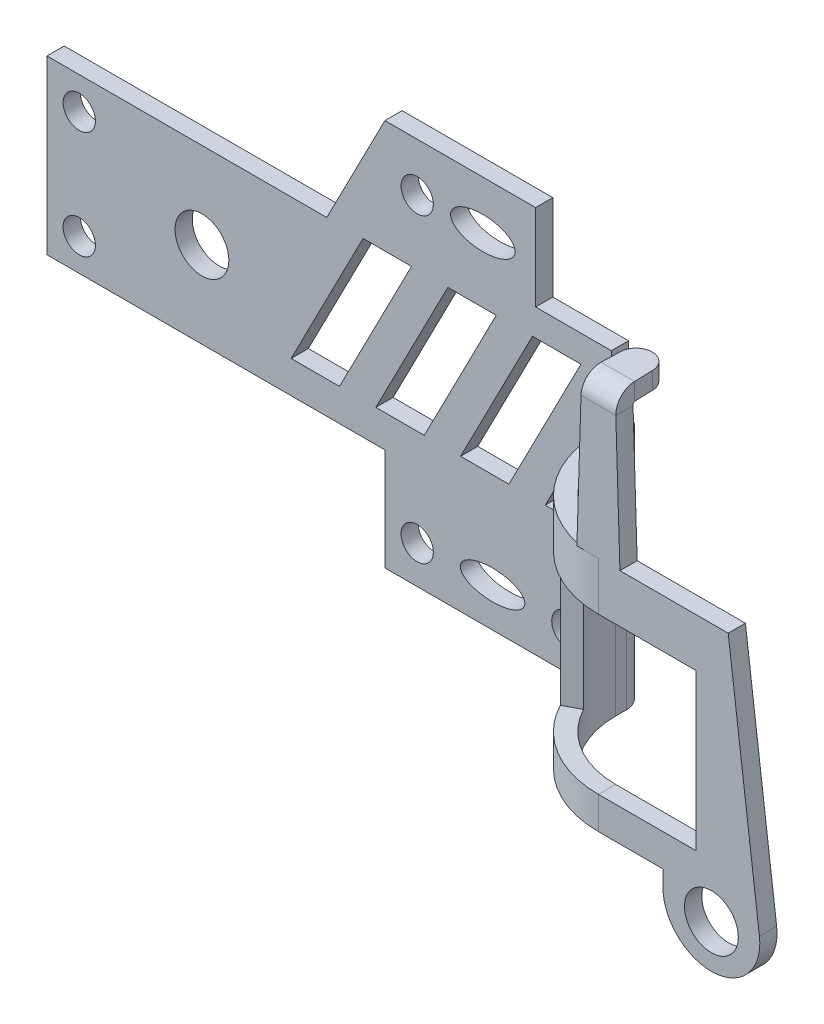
SolidWorks part; units mm, degrees
ref_plane "Face" through (0, 0, 0) normal (0, 0, 1) x (1, 0, 0)
ref_plane "Dessus" through (0, 0, 0) normal (0, 1, 0) x (1, 0, 0)
ref_plane "Droite" through (0, 0, 0) normal (1, 0, 0) x (0, 0, -1)
sketch "Esquisse1" plane through (0, 0, 0) normal (0, 0, 1) x (1, 0, 0)
  line L0 (0, 0) -> (0, 4.75)
  line L1 (0, 4.75) -> (-15.7, 4.75)
  line L2 (-15.7, 4.75) -> (-15.7, 12.75)
  line L3 (-15.7, 12.75) -> (-2.7, 12.75)
  line L4 (-2.7, 12.75) -> (0, 18)
  line L5 (0, 18) -> (7, 18)
  line L6 (7, 18) -> (7, 14)
  line L7 (7, 14) -> (11, 14)
  line L8 (11, 14) -> (11, 11)
  line L9 (11, 11) -> (12.1, 11)
  line L10 (18.95, 11) -> (20.401, -0.4675)
  line L11 (15.9188, 0) -> (12.1, 0)
  line L12 (15.9188, 0) -> (15.9188, -0.75)
  line L13 (18.1688, -3) -> (20.4188, -3) construction
  line L14 (20.4188, -1) -> (20.4188, -3) construction
  line L15 (12.1, 11) -> (18.95, 11)
  line L16 (12.1, 0) -> (0, 0)
  line L17 (12.1, 0) -> (12.1, 11) construction
  line L18 (5, 0) -> (5, 4.5) construction
  line L19 (1.5, 2.5) -> (5, 2.5) construction
  line L20 (1.5, 1.75) -> (1.5, 15.75) construction
  line L21 (-14.2, 6.25) -> (-14.2, 11.25) construction
  line L22 (1.5, 15.75) -> (4.55, 15.75) construction
  line L23 (1.5, 16.5) -> (4.5523, 16.5) construction
  line L24 (-8.5, 8.75) -> (-15.7, 8.75) construction
  line L25 (-4.3561, 6.25) -> (-1.0133, 12.75)
  line L26 (-4.3561, 6.25) -> (-2.1071, 6.25)
  line L27 (-1.0133, 12.75) -> (1.2357, 12.75)
  line L28 (-2.1071, 6.25) -> (1.2357, 12.75)
  line L29 (2.9225, 12.75) -> (5.1715, 12.75)
  line L30 (18.1688, -1) -> (18.1688, -0.75) construction
  line L31 (-0.4204, 6.25) -> (1.8286, 6.25)
  line L32 (1.8286, 6.25) -> (5.1715, 12.75)
  line L33 (-0.4204, 6.25) -> (2.9225, 12.75)
  line L34 (6.8582, 12.75) -> (9.1072, 12.75)
  line L36 (3.5154, 6.25) -> (5.7643, 6.25)
  line L37 (5.7643, 6.25) -> (9.1072, 12.75)
  line L38 (3.5154, 6.25) -> (6.8582, 12.75)
  line L39 (7.4511, 6.25) -> (9.1072, 9.4702)
  line L40 (9.1072, 9.4702) -> (9.1072, 6.25)
  line L41 (9.1072, 6.25) -> (7.4511, 6.25)
  line L42 (-7.8285, 12.75) -> (5.1715, 12.75)
  line L43 (-11.7643, 12.75) -> (1.2357, 12.75)
  arc A0 (15.9188, -0.75) -> (20.401, -0.4675) centre (18.1688, -0.75) ccw
  circle A1 centre (18.1688, -1) radius 1.25
  circle A2 centre (1.5, 1.75) radius 0.75
  circle A3 centre (8.5, 1.75) radius 0.75
  circle A4 centre (1.5, 15.75) radius 0.75
  circle A5 centre (-14.2, 11.25) radius 0.75
  circle A6 centre (-14.2, 6.25) radius 0.75
  circle A7 centre (-8.5, 8.75) radius 1.25
  ellipse E0 centre (5, 1.8173) end of major axis (3.5, 1.8173) minor radius 0.6827
  ellipse E1 centre (4.55, 15.75) end of major axis (6.05, 15.7454) minor radius 0.75
  dimension "D12" = 2.5
  dimension "D14" = 1.5
  dimension "D30" = 2.5
  dimension "D38" = 14
  dimension "D13" = 2.25
  dimension "D2" = 8
  dimension "D3" = 18
  dimension "D4" = 11
  dimension "D5" = 13
  dimension "D6" = 7
  dimension "D7" = 4
  dimension "D8" = 4
  dimension "D9" = 26.7
  dimension "D10" = 6.0688
  dimension "D11" = 3
  dimension "D15" = 1.1
  dimension "D16" = 7.95
  dimension "D17" = 1.75
  dimension "D18" = 1.5
  dimension "D19" = 3.5
  dimension "D20" = 3
  dimension "D21" = 14
  dimension "D22" = 5
  dimension "D23" = 4.5
  dimension "D24" = 15.7
  dimension "D25" = 15.7
  dimension "D26" = 1.5
  dimension "D27" = 2.25
  dimension "D28" = 3.05
  dimension "D29" = 3
  dimension "D31" = 5.7
  dimension "D32" = 1.5
  dimension "D33" = 2
  dimension "D34" = 1.5
  dimension "D35" = 1.5
  dimension "D36" = 1.5
  dimension "D37" = 1
  dimension "D39" = 1.5
sheet metal parameters "Tôlerie 1" thickness 0.8 parameters "D1"=0.7366, "Epaisseur"=0.8
base flange "Tôle de base pliée1" sketch "Esquisse1" thickness 0.8 reverse thickness direction yes parameters "D1"=0.7366
sketch "Esquisse12" plane through (0, 0, 0.8) normal (0, 0, 1) x (1, 0, 0)
  line L0 (12.1, 11) -> (18.95, 11) construction
  line L1 (11, 14) -> (10.42, 14)
  line L2 (11, 14) -> (11, 11)
  line L3 (11, 11) -> (10.42, 11)
  line L4 (10.42, 14) -> (10.42, 11)
  dimension "D1" = 0.58
extrude "Extrusion3" cut sketch "Esquisse12" against normal through all
sketch "Esquisse3" plane through (0, 0, 0.8) normal (0, 0, 1) x (1, 0, 0)
  line L0 (10.42, 11) -> (10.42, 0)
  line L1 (0, 0) -> (15.9188, 0) construction
sketched bend "Pli esquissé1" parameters "D1"=0.1
bend "Pli esquissé2" bend radius 0.1 bend angle 90 parameters "D5"=1
sketch "Esquisse6" plane through (11.32, 0, 0) normal (1, 0, 0) x (0, 0, -1)
  line L1 (-1.4, 11) -> (-1.4, 0)
  line L2 (-8.43, 11) -> (-0.9, 11) construction
  line L3 (-0.9, 0) -> (-5.3988, 0) construction
  dimension "D1" = 1.4
sketched bend "Pli esquissé3" parameters "D1"=4.25
bend "Pli esquissé8" bend radius 4.25 bend angle 90 parameters "D5"=4
sketch "Esquisse5" plane through (17.05, 0, 6.45) normal (0, 0, -1) x (-1, 0, 0)
  line L1 (6.63, 8.75) -> (-3.05, 8.75)
  line L2 (6.63, 8.75) -> (6.63, 1.5)
  line L3 (6.63, 1.5) -> (-3.05, 1.5)
  line L4 (-3.05, 8.75) -> (-3.05, 1.5)
  line L9 (4.95, 11) -> (-1.9, 11) construction
  line L10 (1.1312, 0) -> (4.95, 0) construction
  line L12 (6.63, 11) -> (6.63, 0) construction
  dimension "D1" = 1.5
  dimension "D3" = 2.25
  dimension "D4" = 1.5
  dimension "D5" = 7.25
extrude "Extrusion1" cut sketch "Esquisse5" along normal blind 2.7
sketch "Esquisse7" plane through (0, 0, 5.65) normal (0, 0, 1) x (1, 0, 0)
  line L0 (14.57, 11) -> (14.8204, 19.0234)
  line L1 (16.3196, 19.0234) -> (16.57, 11)
  line L2 (16.57, 11) -> (14.57, 11)
  line L3 (15.57, 11) -> (15.57, 19) construction
  line L4 (14.765, 17.25) -> (16.375, 17.25) construction
  line L5 (21.6, 11) -> (15.57, 11) construction
  line L6 (12.1, 11) -> (18.95, 11) construction
  arc A0 (14.8204, 19.0234) -> (16.3196, 19.0234) centre (15.57, 19) cw
  dimension "D1" = 0.75
  dimension "D2" = 2
  dimension "D3" = 6.25
  dimension "D4" = 5.03
  dimension "D5" = 1.75
extrude "Extrusion2" add sketch "Esquisse7" along normal through all
sketch "Esquisse9" plane through (0, 0, 5.65) normal (0, 0, -1) x (-1, 0, 0)
  line L0 (-14.765, 17.25) -> (-16.375, 17.25)
sketched bend "Pli esquissé5" parameters "D1"=0.1
bend "Pli esquissé6" bend radius 0.1 bend angle 90 parameters "D5"=3
sketch "Esquisse13" plane through (0, 0, 0.8) normal (0, 0, 1) x (1, 0, 0)
  line L1 (10.42, 14) -> (10.52, 14)
  line L2 (10.42, 14) -> (10.42, 11)
  line L3 (10.42, 11) -> (10.52, 11)
  line L4 (10.52, 14) -> (10.52, 11)
extrude "Extrusion5" add sketch "Esquisse13" against normal through all
flat pattern "Etat déplié1"
sketch "Lignes de pliage1" plane through (0, 0, 0) normal (0, 1, 0) x (-1, 0, 0)
bend of the flat pattern "Dépliage-<Pli esquissé2>1"
bend of the flat pattern "Dépliage-<Pli esquissé6>1"
bend of the flat pattern "Dépliage-<Pli esquissé8>1"
